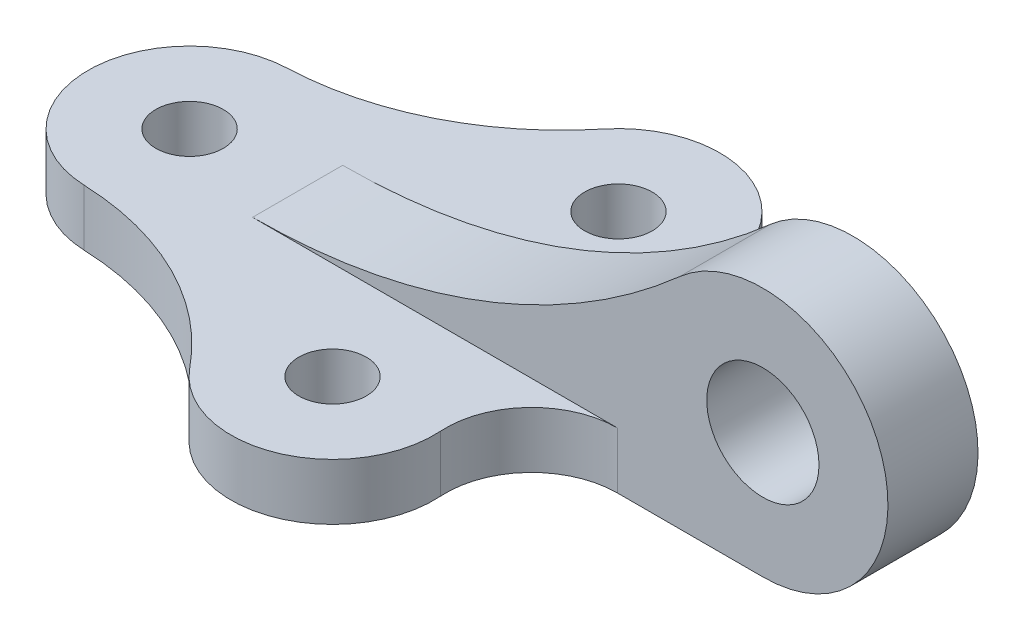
SolidWorks part; units mm, degrees
ref_plane "Front Plane" through (0, 0, 0) normal (0, 0, 1) x (1, 0, 0)
ref_plane "Top Plane" through (0, 0, 0) normal (0, 1, 0) x (1, 0, 0)
ref_plane "Right Plane" through (0, 0, 0) normal (1, 0, 0) x (0, 0, -1)
sketch "Sketch1" plane through (0, 0, 0) normal (0, 1, 0) x (1, 0, 0)
  line L0 (0, 0) -> (248.965, 0) construction
  line L1 (84.0039, 8.001) -> (84.0039, -8.001)
  circle A0 centre (0, 0) radius 5.9944
  arc A1 (-0.6921, 18.0207) -> (-0.6921, -18.0207) centre (0, 0) ccw
  circle A2 centre (50.8, 25.4) radius 5.9944
  arc A3 (68.796, 24.2299) -> (36.7987, 36.7661) centre (50.8, 25.4) ccw
  arc A4 (68.796, 24.2299) -> (84.0039, 8.001) centre (84.0039, 23.241) ccw
  arc A5 (-0.6921, 18.0207) -> (36.7987, 36.7661) centre (-2.6416, 68.7833) ccw
  arc A6 (68.796, -24.2299) -> (84.0039, -8.001) centre (84.0039, -23.241) cw
  arc A7 (68.796, -24.2299) -> (36.7987, -36.7661) centre (50.8, -25.4) cw
  circle A8 centre (50.8, -25.4) radius 5.9944
  arc A9 (-0.6921, -18.0207) -> (36.7987, -36.7661) centre (-2.6416, -68.7833) cw
  point P3 (95.2911, 5.4324)
  point P9 (95.6658, 7.3057)
  point P17 (84.0039, 0)
  dimension "D1" = 11.9888
  dimension "D2" = 18.034
  dimension "D3" = 50.8
  dimension "D5" = 15.24
  dimension "D4" = 50.8
  dimension "D6" = 16.002
  dimension "D7" = 50.8
extrude "Boss-Extrude1" add sketch "Sketch1" along normal blind 10.0076
sketch "Sketch2" plane through (0, 0, 0) normal (0, 0, 1) x (1, 0, 0)
  line L0 (68.7639, 0) -> (84.0039, 0) construction
  line L1 (68.834, 10.0076) -> (36.7987, 10.0076) construction
  line L2 (19.2006, 10.0076) -> (19.2006, 0)
  line L3 (-0.6921, 0) -> (36.7987, 0) construction
  line L4 (19.2006, 0) -> (109.855, 0)
  circle A0 centre (109.855, 22.225) radius 9.9695
  arc A1 (109.855, 0) -> (95.0973, 38.8431) centre (109.855, 22.225) ccw
  arc A2 (19.2006, 10.0076) -> (95.0973, 38.8431) centre (19.2006, 124.3076) ccw
  dimension "D1" = 44.45
  dimension "D2" = 19.939
  dimension "D3" = 228.6
  dimension "D4" = 109.855
extrude "Boss-Extrude2" add sketch "Sketch2" along normal up to vertex (8.001 mm away) and the other way up to vertex (8.001 mm away)
